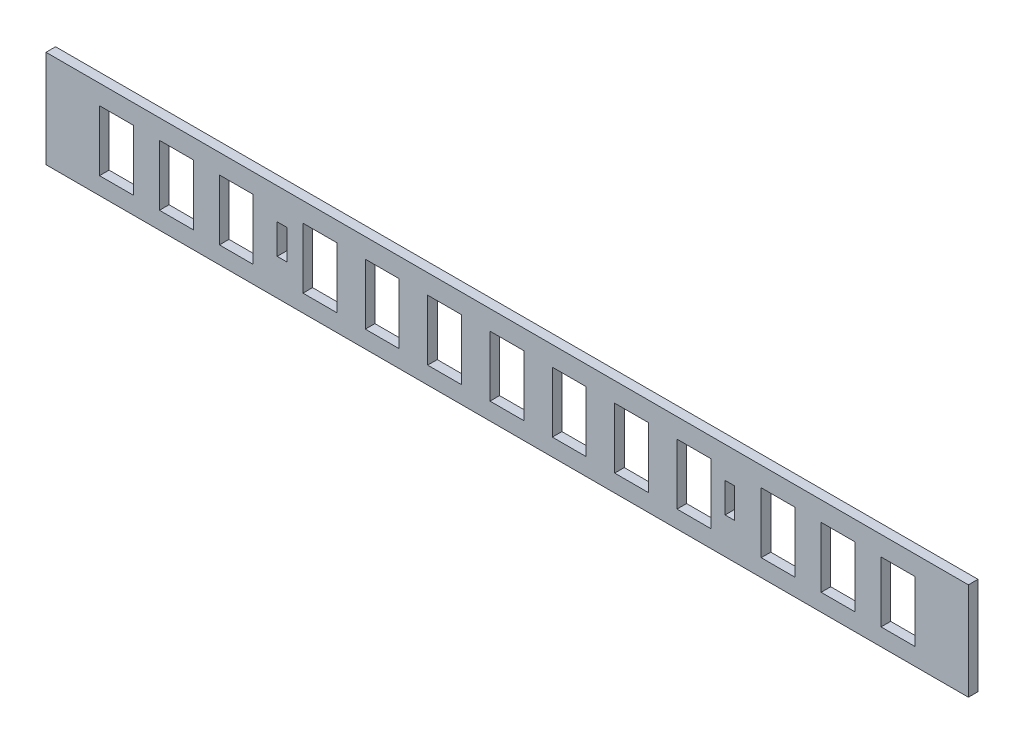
SolidWorks part; units mm, degrees
ref_plane "Front Plane" through (0, 0, 0) normal (0, 0, 1) x (1, 0, 0)
ref_plane "Top Plane" through (0, 0, 0) normal (0, 1, 0) x (1, 0, 0)
ref_plane "Right Plane" through (0, 0, 0) normal (1, 0, 0) x (0, 0, -1)
sketch "Sketch1" plane through (0, 0, 0) normal (0, 0, 1) x (1, 0, 0)
  line L1 (0, 159.312) -> (1.524, 159.312)
  line L2 (0, 159.312) -> (0, 154.5495)
  line L3 (0, 154.5495) -> (1.524, 154.5495)
  line L4 (1.524, 159.312) -> (1.524, 154.5495)
  line L5 (71.1696, 154.5495) -> (72.6936, 154.5495)
  line L6 (71.1696, 154.5495) -> (71.1696, 159.312)
  line L7 (71.1696, 159.312) -> (72.6936, 159.312)
  line L8 (72.6936, 154.5495) -> (72.6936, 159.312)
  line L9 (109.8394, 148.7964) -> (-36.736, 148.7964)
  line L10 (109.8394, 148.7964) -> (109.8394, 164.2702)
  line L11 (109.8394, 164.2702) -> (-36.736, 164.2702)
  line L12 (-36.736, 148.7964) -> (-36.736, 164.2702)
  line L13 (-28.2307, 151.5402) -> (-22.8591, 151.5402)
  line L14 (-28.2307, 151.5402) -> (-28.2307, 161.1671)
  line L15 (-28.2307, 161.1671) -> (-22.8591, 161.1671)
  line L16 (-22.8591, 151.5402) -> (-22.8591, 161.1671)
  line L17 (-18.7057, 151.5402) -> (-13.3341, 151.5402)
  line L18 (-18.7057, 151.5402) -> (-18.7057, 161.1671)
  line L19 (-18.7057, 161.1671) -> (-13.3341, 161.1671)
  line L20 (-13.3341, 151.5402) -> (-13.3341, 161.1671)
  line L21 (-9.1807, 151.5402) -> (-3.8091, 151.5402)
  line L22 (-9.1807, 151.5402) -> (-9.1807, 161.1671)
  line L23 (-9.1807, 161.1671) -> (-3.8091, 161.1671)
  line L24 (-3.8091, 151.5402) -> (-3.8091, 161.1671)
  line L25 (36.5517, 164.2702) -> (36.5517, 196.9383) construction
  line L27 (4.1016, 151.5402) -> (9.4732, 151.5402)
  line L28 (4.1016, 161.1671) -> (9.4732, 161.1671)
  line L29 (9.4732, 151.5402) -> (9.4732, 161.1671)
  line L30 (4.1016, 151.5402) -> (4.1016, 161.1671)
  line L31 (14.0076, 151.5402) -> (19.3792, 151.5402)
  line L32 (14.0076, 161.1671) -> (19.3792, 161.1671)
  line L33 (19.3792, 151.5402) -> (19.3792, 161.1671)
  line L34 (14.0076, 151.5402) -> (14.0076, 161.1671)
  line L35 (23.9136, 151.5402) -> (29.2852, 151.5402)
  line L36 (23.9136, 161.1671) -> (29.2852, 161.1671)
  line L37 (29.2852, 151.5402) -> (29.2852, 161.1671)
  line L38 (23.9136, 151.5402) -> (23.9136, 161.1671)
  line L39 (33.8196, 151.5402) -> (39.1912, 151.5402)
  line L40 (33.8196, 161.1671) -> (39.1912, 161.1671)
  line L41 (39.1912, 151.5402) -> (39.1912, 161.1671)
  line L42 (33.8196, 151.5402) -> (33.8196, 161.1671)
  line L43 (43.7256, 151.5402) -> (49.0972, 151.5402)
  line L44 (43.7256, 161.1671) -> (49.0972, 161.1671)
  line L45 (49.0972, 151.5402) -> (49.0972, 161.1671)
  line L46 (43.7256, 151.5402) -> (43.7256, 161.1671)
  line L47 (53.6316, 151.5402) -> (59.0032, 151.5402)
  line L48 (53.6316, 161.1671) -> (59.0032, 161.1671)
  line L49 (59.0032, 151.5402) -> (59.0032, 161.1671)
  line L50 (53.6316, 151.5402) -> (53.6316, 161.1671)
  line L51 (63.5376, 151.5402) -> (68.9092, 151.5402)
  line L52 (63.5376, 161.1671) -> (68.9092, 161.1671)
  line L53 (68.9092, 151.5402) -> (68.9092, 161.1671)
  line L54 (63.5376, 151.5402) -> (63.5376, 161.1671)
  line L55 (-38.26, 164.2702) -> (111.3634, 164.2702) construction
  line L56 (76.9125, 151.5402) -> (76.9125, 161.1671)
  line L57 (82.2842, 161.1671) -> (76.9125, 161.1671)
  line L58 (82.2842, 151.5402) -> (82.2842, 161.1671)
  line L59 (82.2842, 151.5402) -> (76.9125, 151.5402)
  line L60 (86.4375, 151.5402) -> (86.4375, 161.1671)
  line L61 (91.8092, 161.1671) -> (86.4375, 161.1671)
  line L62 (91.8092, 151.5402) -> (91.8092, 161.1671)
  line L63 (91.8092, 151.5402) -> (86.4375, 151.5402)
  line L64 (95.9625, 151.5402) -> (95.9625, 161.1671)
  line L65 (101.3342, 161.1671) -> (95.9625, 161.1671)
  line L66 (101.3342, 151.5402) -> (101.3342, 161.1671)
  line L67 (101.3342, 151.5402) -> (95.9625, 151.5402)
extrude "Boss-Extrude1" add sketch "Sketch1" along normal blind 1.524
